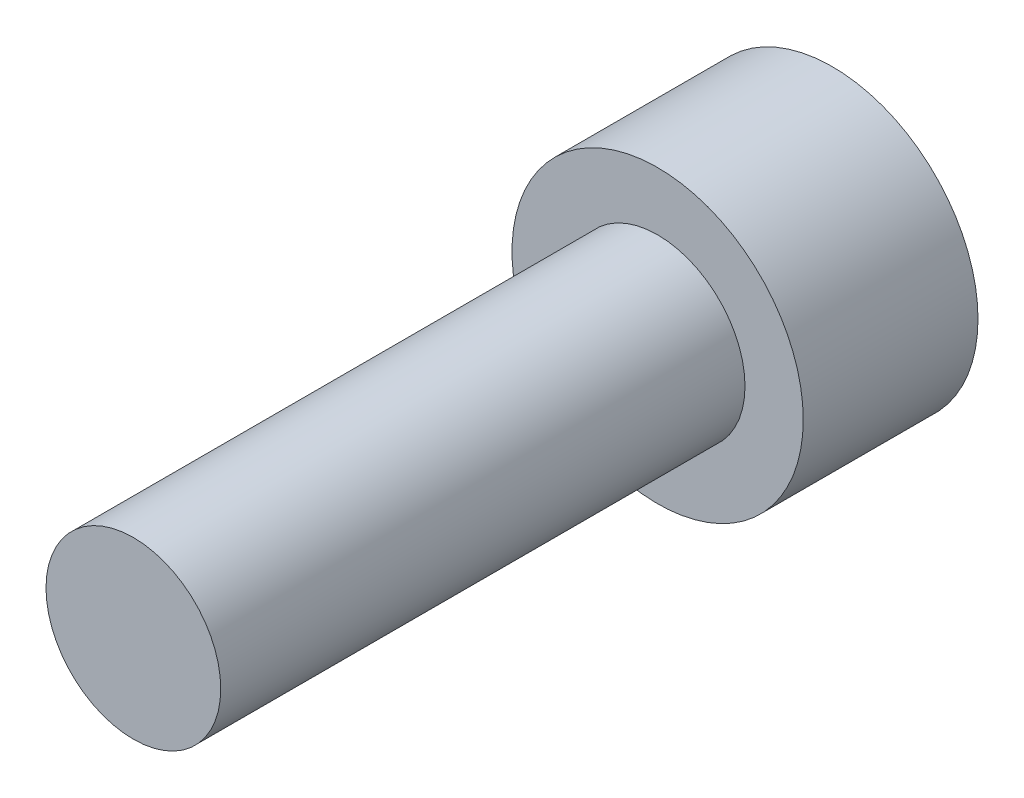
SolidWorks part; units mm, degrees
ref_plane "Front Plane" through (0, 0, 0) normal (0, 0, 1) x (1, 0, 0)
ref_plane "Top Plane" through (0, 0, 0) normal (0, 1, 0) x (1, 0, 0)
ref_plane "Right Plane" through (0, 0, 0) normal (1, 0, 0) x (0, 0, -1)
sketch "Sketch6" plane through (0, 0, 0) normal (1, 0, 0) x (0, 0, -1)
  line L0 (-18, 0) -> (22.525, 0) construction
  line L1 (5.5, 0) -> (-5.5, 0) construction
  line L2 (-18, 0) -> (-18, -3)
  line L3 (-18, -3) -> (0, -3)
  line L4 (0, 5.5) -> (0, -5.5) construction
  line L5 (0, -3) -> (0, -5)
  line L6 (0, -5) -> (6, -5)
  line L7 (6, -5) -> (6, 0)
  line L8 (6, 0) -> (-18, 0)
  dimension "L" = 18
  dimension "H" = 6
  dimension "A" = 10
  dimension "D" = 6
revolve "Revolve1" add sketch "Sketch6" angle 360 about L0
sketch "Sketch7" plane through (0, 0, -6) normal (0, 0, -1) x (-1, 0, 0)
  line L2 (-2.5, 1.4434) -> (-2.5, -1.4434)
  line L4 (-2.5, -1.4434) -> (0, -2.8868)
  line L5 (0, -2.8868) -> (2.5, -1.4434)
  line L6 (2.5, -1.4434) -> (2.5, 1.4434)
  line L7 (2.5, 1.4434) -> (0, 2.8868)
  line L8 (0, 2.8868) -> (-2.5, 1.4434)
  circle A0 centre (0, 0) radius 2.5 construction
  dimension "J" = 5
extrude "HEX" cut sketch "Sketch7" against normal blind 5
